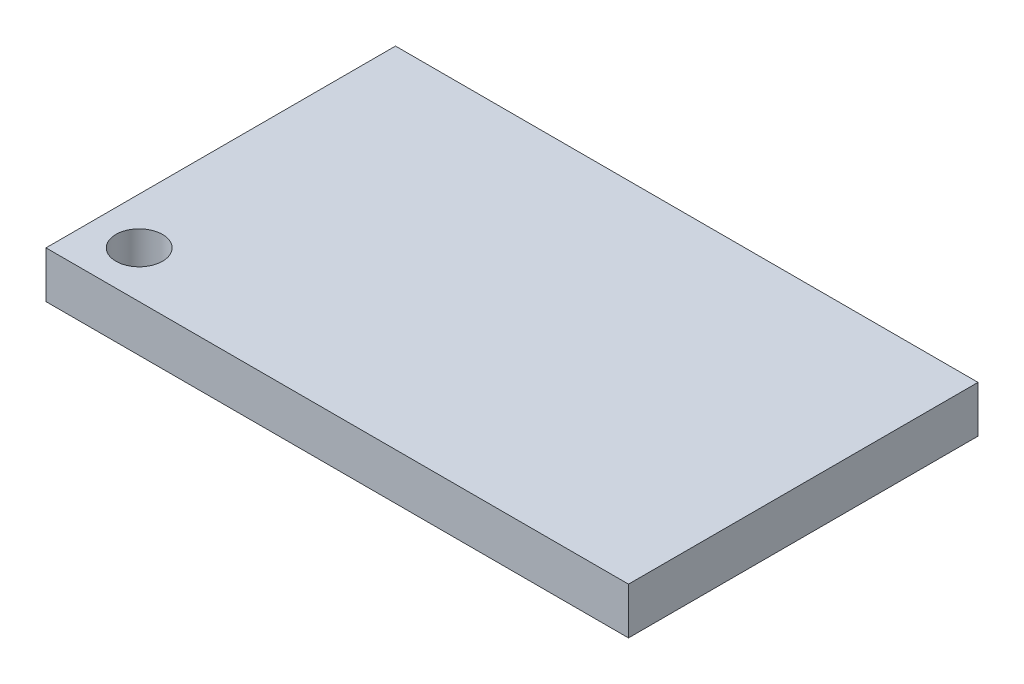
SolidWorks part; units mm, degrees
ref_plane "Front Plane" through (0, 0, 0) normal (0, 0, 1) x (1, 0, 0)
ref_plane "Top Plane" through (0, 0, 0) normal (0, 1, 0) x (1, 0, 0)
ref_plane "Right Plane" through (0, 0, 0) normal (1, 0, 0) x (0, 0, -1)
sketch "Sketch1" plane through (0, 0, 0) normal (0, 1, 0) x (1, 0, 0)
  line L1 (0, 0) -> (125, 0)
  line L2 (0, 0) -> (0, 75)
  line L3 (0, 75) -> (125, 75)
  line L4 (125, 0) -> (125, 75)
  dimension "D1" = 75
  dimension "D2" = 125
extrude "Extrude1" add sketch "Sketch1" along normal blind 10
sketch "Sketch2" plane through (0, 10, 0) normal (0, 1, 0) x (-1, 0, 0)
  line L0 (0, 0) -> (-125, 0) construction
  line L1 (0, -75) -> (0, 0) construction
  circle A0 centre (-10, -10) radius 5
  dimension "D1" = 10
  dimension "D2" = 10
  dimension "D3" = 10
extrude "Cut-Extrude1" cut sketch "Sketch2" against normal blind 10
